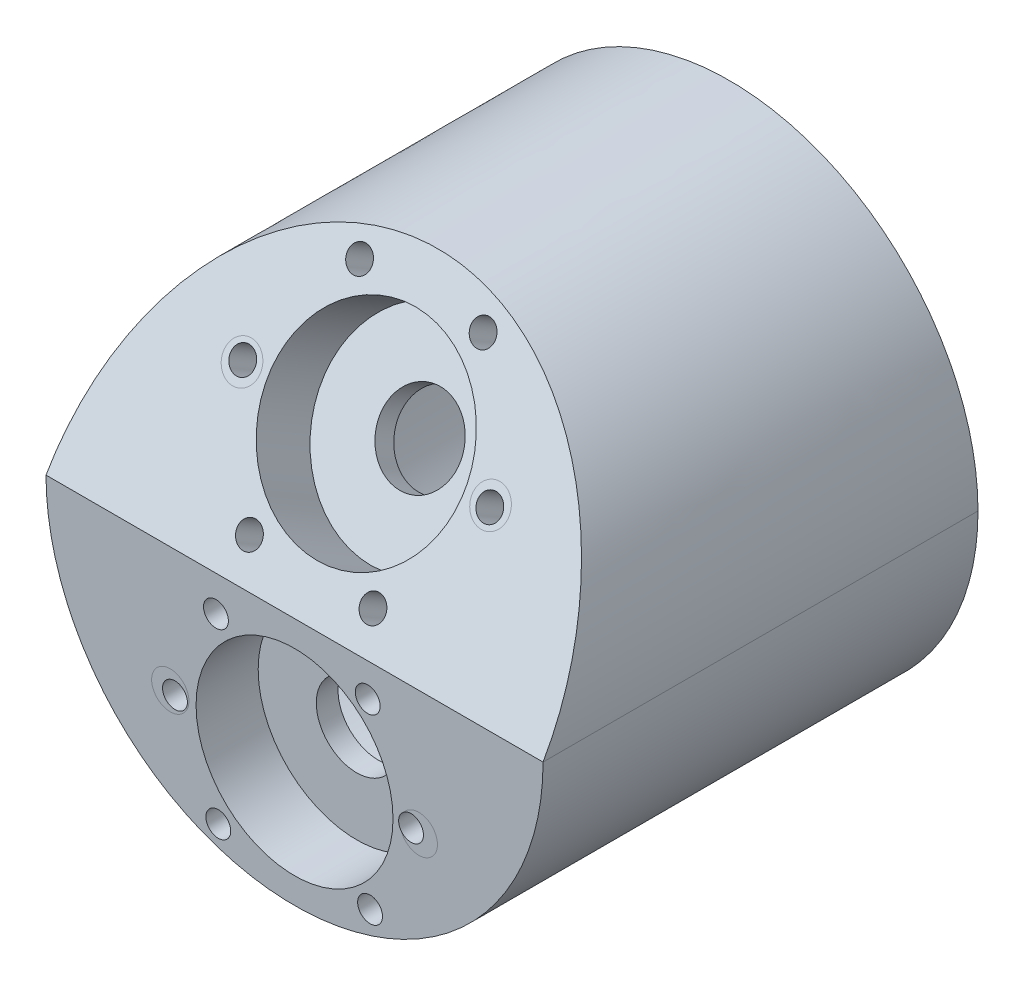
SolidWorks part; units mm, degrees
other "Markup1"
sketch "Sketch15" plane through (-40.005, -40.005, 70.421) normal (-0.8401, -0.1326, 0.5261) x (0.2304, -0.9651, 0.1248)
other "Markup2"
sketch "Sketch29" plane through (40.005, 40.005, 70.421) normal (0.8496, 0.3406, 0.4027) x (-0.3119, 0.9402, -0.1372)
ref_plane "Front Plane" through (0, 0, 0) normal (0, 0, 1) x (1, 0, 0)
ref_plane "Top Plane" through (0, 0, 0) normal (0, 1, 0) x (1, 0, 0)
ref_plane "Right Plane" through (0, 0, 0) normal (1, 0, 0) x (0, 0, -1)
imported_body "head by amin.IGS<1>"
ref_plane "Plane1" through (0, 0, 70) normal (0, 0, 1) x (1, 0, 0)
ref_plane "Plane2" through (0, 30.3109, 52.5) normal (0, -0.5, -0.866) x (-1, 0, 0)
ref_plane "Plane3" through (0, 0, 62.5) normal (0, 0, -1) x (-1, 0, 0)
sketch "Sketch8" plane through (0, 0, 62.5) normal (0, 0, -1) x (-1, 0, 0)
  line L1 (32.4378, -2.0096) -> (-32.4378, -2.0096)
  line L2 (32.4378, -2.0096) -> (-32.4378, -2.0096)
  arc A0 (9.5, -20) -> (-9.5, -20) centre (0, -20) ccw construction
  arc A1 (-32.4378, -2.0096) -> (32.4378, -2.0096) centre (0, 0) ccw
  arc A2 (-32.4378, -2.0096) -> (32.4378, -2.0096) centre (0, 0) ccw
  arc A3 (9.5, -20) -> (-9.5, -20) centre (0, -20) ccw
  arc A4 (-9.5, -20) -> (9.5, -20) centre (0, -20) ccw construction
  arc A5 (-9.5, -20) -> (9.5, -20) centre (0, -20) ccw
  dimension "D1" = 0
extrude "Boss-Extrude2" add sketch "Sketch8" along normal blind 6
ref_plane "Plane4" through (0, 26.561, 46.0048) normal (0, 0.5, 0.866) x (1, 0, 0)
sketch "Sketch9" plane through (0, 26.561, 46.0048) normal (0, 0.5, 0.866) x (1, 0, 0)
  line L1 (-32.4378, -32.9905) -> (32.4378, -32.9905)
  line L2 (-32.4378, -32.9905) -> (32.4378, -32.9905)
  spline S0 degree 3 poles (0, -2.4061) (5.565, -2.4061) (9.5, -6.3411) (9.5, -11.9061) (9.5, -17.471) (5.565, -21.4061) (0, -21.4061) knots 0 0 0 0 0.5 0.5 0.5 1 1 1 1 weights 1 0.804738 0.804738 1 0.804738 0.804738 1 construction
  spline S1 degree 3 poles (0, -2.4061) (5.565, -2.4061) (9.5, -6.3411) (9.5, -11.9061) (9.5, -17.471) (5.565, -21.4061) (0, -21.4061) knots 0 0 0 0 0.5 0.5 0.5 1 1 1 1 weights 1 0.804738 0.804738 1 0.804738 0.804738 1
  spline S2 degree 3 poles (0, -21.4061) (-19, -21.4061) (-19, -2.4061) (0, -2.4061) knots 0 0 0 0 1 1 1 1 weights 1 0.333333 0.333333 1 construction
  spline S3 degree 3 poles (-3031.7333, 8.6425) (-7.8523, 16.7552) (-32.9795, -7.5623) (-32.4871, -31.7637) (-32.4727, -32.2278) (-31.646, -52.5501) (-13.3464, -71.8844) (-3025.1205, -235.5511) knots -30.598334 -30.598334 -30.598334 -30.598334 0.253353 0.48003 0.68003 0.853353 26.761862 26.761862 26.761862 26.761862 only from (-32.5, -30.6699) to (-32.4378, -32.9905)
  spline S4 degree 3 poles (3031.5559, -68.1989) (5.4689, -80.4114) (33.0852, -54.82) (32.4822, -29.3838) (32.4612, -28.8079) (32.4351, -28.2824) (32.4061, -27.8074) (32.3757, -27.3826) (32.302, -26.4719) (32.157, -25.1293) (31.8793, -23.295) (31.535, -21.5309) (30.9673, -19.1688) (30.0798, -16.3009) (28.7165, -12.9685) (26.5461, -8.7813) (23.1923, -4.0361) (18.2461, 0.6778) (12.5836, 4.1943) (6.4209, 6.3668) (0, 7.1018) (-6.4209, 6.3668) (-12.5836, 4.1943) (-18.2461, 0.6778) (-23.1923, -4.0361) (-26.5461, -8.7813) (-28.7165, -12.9685) (-30.0798, -16.3009) (-30.9673, -19.1688) (-31.535, -21.5309) (-31.8793, -23.295) (-32.157, -25.1293) (-32.3229, -26.6638) (-32.424, -28.034) (-34.1166, -61.4508) (13.4055, -95.8838) (-3031.4155, -46.0582) knots -0.676716 -0.676716 -0.676716 -0.676716 0.00615 0.011844 0.017082 0.021865 0.026191 0.030062 0.033476 0.051109 0.06687 0.084055 0.100107 0.133105 0.165807 0.198159 0.261578 0.323254 0.383274 0.441995 0.500001 0.558006 0.616727 0.676747 0.738423 0.801842 0.834194 0.866896 0.899894 0.915946 0.933131 0.948892 0.966525 0.975201 0.98636 1.878758 1.878758 1.878758 1.878758 only from (32.5, -30.6699) to (-32.5, -30.6699)
  spline S5 degree 3 poles (3024.3493, -243.9965) (5.6907, -81.0358) (31.7037, -57.0316) (33.3638, -3.546) (-0.8803, 25.5893) (3031.5049, 6.4697) knots -31.929204 -31.929204 -31.929204 -31.929204 0.259233 0.592566 37.211828 37.211828 37.211828 37.211828 only from (32.4378, -32.9905) to (32.5, -30.6699)
  spline S6 degree 3 poles (-32.5, -30.6699) (-32.4992, -30.866) (-32.4978, -31.2375) (-32.4871, -31.7637) (-32.4727, -32.2278) (-32.4563, -32.6298) (-32.4436, -32.8771) (-32.4378, -32.9905) knots 0 0 0 0 0.253353 0.48003 0.68003 0.853353 1 1 1 1
  spline S7 degree 3 poles (32.5, -30.6699) (32.499, -30.4444) (32.497, -30.0101) (32.4822, -29.3838) (32.4612, -28.8079) (32.4351, -28.2824) (32.4061, -27.8074) (32.3757, -27.3826) (32.302, -26.4719) (32.157, -25.1293) (31.8793, -23.295) (31.535, -21.5309) (30.9673, -19.1688) (30.0798, -16.3009) (28.7165, -12.9685) (26.5461, -8.7813) (23.1923, -4.0361) (18.2461, 0.6778) (12.5836, 4.1943) (6.4209, 6.3668) (0, 7.1018) (-6.4209, 6.3668) (-12.5836, 4.1943) (-18.2461, 0.6778) (-23.1923, -4.0361) (-26.5461, -8.7813) (-28.7165, -12.9685) (-30.0798, -16.3009) (-30.9673, -19.1688) (-31.535, -21.5309) (-31.8793, -23.295) (-32.157, -25.1293) (-32.3229, -26.6638) (-32.424, -28.034) (-32.4861, -29.2603) (-32.4951, -30.1697) (-32.5, -30.6699) knots 0 0 0 0 0.00615 0.011844 0.017082 0.021865 0.026191 0.030062 0.033476 0.051109 0.06687 0.084055 0.100107 0.133105 0.165807 0.198159 0.261578 0.323254 0.383274 0.441995 0.500001 0.558006 0.616727 0.676747 0.738423 0.801842 0.834194 0.866896 0.899894 0.915946 0.933131 0.948892 0.966525 0.975201 0.98636 1 1 1 1
  spline S8 degree 3 poles (32.4378, -32.9905) (32.4477, -32.7901) (32.4703, -32.3321) (32.4943, -31.5585) (32.498, -30.9852) (32.5, -30.6699) knots 0 0 0 0 0.259233 0.592566 1 1 1 1
  spline S9 degree 3 poles (0, -21.4061) (-19, -21.4061) (-19, -2.4061) (0, -2.4061) knots 0 0 0 0 1 1 1 1 weights 1 0.333333 0.333333 1
  dimension "D1" = 0
sketch "Sketch16" plane through (0, 0, 70) normal (0, 0, 1) x (1, 0, 0)
  circle A0 centre (0, -20) radius 9.5
  circle A1 centre (0, -20) radius 15.85
  dimension "D1" = 31.7
  dimension "D2" = 19
extrude "Cut-Extrude16" cut sketch "Sketch16" against normal blind 10
ref_plane "Plane5" through (0, 0, 30) normal (0, 0, 1) x (1, 0, 0)
sketch "Sketch13" plane through (0, 0, 70) normal (0, 0, 1) x (1, 0, 0)
  circle A0 centre (-20, -20) radius 3
  circle A1 centre (20, -20) radius 3
  dimension "D1" = 6
  dimension "D2" = 6
extrude "Boss-Extrude4" add sketch "Sketch13" against normal up to next
sketch "Sketch17" plane through (0, 0, 60) normal (0, 0, 1) x (1, 0, 0)
  circle A0 centre (0, -20) radius 6.5
  circle A1 centre (0, -20) radius 9.5 construction
  circle A2 centre (0, -20) radius 9.5
  dimension "D1" = 13
extrude "Boss-Extrude11" add sketch "Sketch17" against normal up to surface (3.5 mm away)
ref_plane "Plane6" through (0, 26.561, 46.0048) normal (0, -0.5, -0.866) x (-1, 0, 0)
sketch "Sketch20" plane through (0, 26.561, 46.0048) normal (0, -0.5, -0.866) x (-1, 0, 0)
  line L1 (-32.4378, -32.9905) -> (32.4378, -32.9905)
  line L2 (-32.4378, -32.9905) -> (32.4378, -32.9905)
  spline S3 degree 3 poles (3025.105, -235.5503) (13.3464, -71.8844) (31.646, -52.5501) (32.4727, -32.2278) (32.4871, -31.7637) (32.9795, -7.5625) (7.8526, 16.755) (3031.6812, 8.6426) knots -25.761818 -25.761818 -25.761818 -25.761818 0.146647 0.31997 0.51997 0.746647 31.598157 31.598157 31.598157 31.598157 only from (32.4378, -32.9905) to (32.5, -30.6699)
  spline S4 degree 3 poles (1031.6959, -70.61) (10.5749, -75.453) (33.6164, -51.5741) (32.424, -28.034) (32.3229, -26.6638) (32.157, -25.1293) (31.8793, -23.295) (31.535, -21.5309) (30.9673, -19.1688) (30.0798, -16.3009) (28.7165, -12.9685) (26.5461, -8.7813) (23.1923, -4.0361) (18.2461, 0.6778) (12.5836, 4.1943) (6.4209, 6.3668) (0, 7.1018) (-6.4209, 6.3668) (-12.5836, 4.1943) (-18.2461, 0.6778) (-23.1923, -4.0361) (-26.5461, -8.7813) (-28.7165, -12.9685) (-30.0798, -16.3009) (-30.9673, -19.1688) (-31.535, -21.5309) (-31.8793, -23.295) (-32.157, -25.1293) (-32.302, -26.4719) (-32.3757, -27.3826) (-32.4061, -27.8074) (-32.4351, -28.2824) (-32.4612, -28.8079) (-32.4822, -29.3838) (-32.9048, -47.2088) (-19.5568, -65.0113) (-1031.6993, -69.9797) knots -0.609137 -0.609137 -0.609137 -0.609137 0.01364 0.024799 0.033475 0.051108 0.066869 0.084054 0.100106 0.133104 0.165806 0.198158 0.261577 0.323253 0.383273 0.441994 0.499999 0.558005 0.616726 0.676746 0.738422 0.801841 0.834193 0.866895 0.899893 0.915945 0.93313 0.948891 0.966524 0.969938 0.973809 0.978135 0.982918 0.988156 0.99385 1.469114 1.469114 1.469114 1.469114 only from (32.5, -30.6699) to (-32.5, -30.6699)
  spline S5 degree 3 poles (-3031.4686, 6.4699) (0.88, 25.5891) (-33.3638, -3.5462) (-31.7037, -57.0316) (-5.6908, -81.0358) (-3024.3437, -243.9962) knots -36.211683 -36.211683 -36.211683 -36.211683 0.407434 0.740767 32.929184 32.929184 32.929184 32.929184 only from (-32.5, -30.6699) to (-32.4378, -32.9905)
  spline S6 degree 3 poles (32.4378, -32.9905) (32.4436, -32.8771) (32.4563, -32.6298) (32.4727, -32.2278) (32.4871, -31.7637) (32.5319, -29.5599) (32.3876, -27.5089) (33.5866, -25.6475) knots 0 0 0 0 0.146647 0.31997 0.51997 0.746647 3.168177 3.168177 3.168177 3.168177
  spline S7 degree 3 poles (33.5866, -25.6475) (33.5815, -25.1338) (33.5723, -24.1997) (33.5085, -22.9402) (33.4047, -21.5328) (33.2343, -19.9567) (32.949, -18.0727) (32.5954, -16.2608) (32.0123, -13.8346) (31.1008, -10.889) (29.7005, -7.4662) (27.4713, -3.1655) (24.0266, 1.7083) (18.9463, 6.55) (13.1303, 10.1618) (6.8005, 12.3931) (0.2056, 13.1481) (-6.3893, 12.3931) (-12.7191, 10.1618) (-18.5351, 6.55) (-23.6154, 1.7083) (-27.0601, -3.1655) (-29.2893, -7.4662) (-30.6896, -10.889) (-31.6011, -13.8346) (-32.1842, -16.2608) (-32.5378, -18.0727) (-32.8231, -19.9567) (-32.972, -21.3357) (-33.0477, -22.2711) (-33.0789, -22.7074) (-33.1087, -23.1953) (-33.1355, -23.735) (-33.1571, -24.3265) (-33.1723, -24.9698) (-33.1743, -25.4159) (-33.1754, -25.6475) knots 0 0 0 0 0.01364 0.024799 0.033475 0.051108 0.066869 0.084054 0.100106 0.133104 0.165806 0.198158 0.261577 0.323253 0.383273 0.441994 0.499999 0.558005 0.616726 0.676746 0.738422 0.801841 0.834193 0.866895 0.899893 0.915945 0.93313 0.948891 0.966524 0.969938 0.973809 0.978135 0.982918 0.988156 0.99385 1 1 1 1
  spline S8 degree 3 poles (-33.1754, -25.6475) (-32.3986, -27.6284) (-32.5464, -29.8817) (-32.4703, -32.3321) (-32.4477, -32.7901) (-32.4378, -32.9905) knots -2.167663 -2.167663 -2.167663 -2.167663 0.407434 0.740767 1 1 1 1
  dimension "D1" = 0
extrude "Boss-Extrude8" add sketch "Sketch20" along normal blind 6
sketch "Sketch21" plane through (0, 30.3109, 52.5) normal (0, -0.5, -0.866) x (-1, 0, 0)
  circle A0 centre (0, -11.906) radius 9.5
  circle A1 centre (0, -11.906) radius 15.85
  point P3 (0, -11.906)
  dimension "D1" = 31.7
  dimension "D2" = 19
extrude "Cut-Extrude19" cut sketch "Sketch21" along normal blind 10
sketch "Sketch22" plane through (0, 26.561, 46.0048) normal (0, 0.5, 0.866) x (1, 0, 0)
  circle A0 centre (0, -11.9061) radius 10.5
  dimension "D2" = 21
extrude "Cut-Extrude20" cut sketch "Sketch22" against normal blind 10
sketch "Sketch23" plane through (0, 26.561, 46.0048) normal (0, 0.5, 0.866) x (1, 0, 0)
  arc A2 (-20, -8.9061) -> (-20, -14.9061) centre (-20, -11.9061) ccw
  arc A3 (-20, -14.9061) -> (-20, -8.9061) centre (-20, -11.9061) ccw
  arc A4 (-20, -8.9061) -> (-20, -14.9061) centre (-20, -11.9061) ccw
  arc A5 (-20, -14.9061) -> (-20, -8.9061) centre (-20, -11.9061) ccw
  dimension "D1" = 0
extrude "Boss-Extrude9" add sketch "Sketch23" along normal up to vertex (7.5 mm away)
sketch "Sketch24" plane through (0, 26.561, 46.0048) normal (0, 0.5, 0.866) x (1, 0, 0)
  arc A2 (20, -8.9061) -> (20, -14.9061) centre (20, -11.9061) ccw
  arc A3 (20, -14.9061) -> (20, -8.9061) centre (20, -11.9061) ccw
  arc A4 (20, -8.9061) -> (20, -14.9061) centre (20, -11.9061) ccw
  arc A5 (20, -14.9061) -> (20, -8.9061) centre (20, -11.9061) ccw
  dimension "D1" = 0
extrude "Boss-Extrude10" add sketch "Sketch24" along normal up to vertex
ref_plane "Plane7" through (0, 30.3109, 52.5) normal (0, -0.5, -0.866) x (-1, 0, 0)
sketch "Sketch25" plane through (0, 30.3109, 52.5) normal (0, -0.5, -0.866) x (-1, 0, 0)
  circle A1 centre (-9.7963, -29.3425) radius 2
  circle A2 centre (-9.7963, -29.3425) radius 2
  circle A3 centre (-19.9986, -12.1405) radius 2
  circle A4 centre (-19.9986, -12.1405) radius 2
  circle A5 centre (10.2024, -29.1081) radius 2
  circle A6 centre (10.2024, -29.1081) radius 2
  circle A7 centre (19.9986, -11.6715) radius 2
  circle A8 centre (19.9986, -11.6715) radius 2
  circle A9 centre (9.7963, 5.5306) radius 2
  circle A10 centre (9.7963, 5.5306) radius 2
  circle A11 centre (-10.2024, 5.2961) radius 2
  circle A12 centre (-10.2024, 5.2961) radius 2
  dimension "D1" = 0
  dimension "D2" = 0
  dimension "D3" = 0
  dimension "D4" = 0
  dimension "D5" = 0
  dimension "D6" = 0
extrude "Cut-Extrude21" cut sketch "Sketch25" along normal blind 9
sketch "Sketch26" plane through (0, 0, 70) normal (0, 0, 1) x (1, 0, 0)
ref_plane "Plane8" through (0, 0, 70) normal (0, 0, 1) x (1, 0, 0)
sketch "Sketch27" plane through (0, 0, 70) normal (0, 0, 1) x (1, 0, 0)
  circle A6 centre (-12.6443, -5.6585) radius 2
  circle A8 centre (18.7543, -19.8084) radius 2
  circle A9 centre (-19.2425, -20.2999) radius 2
  circle A10 centre (11.7796, -5.3426) radius 2
  circle A11 centre (-12.2678, -34.7657) radius 2
  circle A12 centre (12.1561, -34.4498) radius 2
  dimension "D1" = 4
extrude "Cut-Extrude22" cut sketch "Sketch27" against normal blind 9
sketch "Sketch28" plane through (0, 25.3109, 43.8397) normal (0, 0.5, 0.866) x (1, 0, 0)
  circle A0 centre (0, -11.906) radius 10.5 construction
  circle A1 centre (0, -11.906) radius 10.5
  circle A2 centre (0, -11.906) radius 6.5
  dimension "D1" = 13
extrude "Boss-Extrude12" add sketch "Sketch28" against normal up to surface (3.5 mm away)
